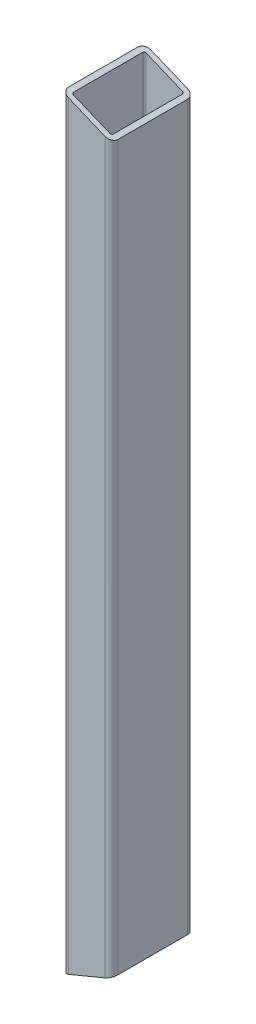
SolidWorks part; units mm, degrees
ref_plane "Plan de face" through (0, 0, 0) normal (0, 0, 1) x (1, 0, 0)
ref_plane "Plan de dessus" through (0, 0, 0) normal (0, 1, 0) x (1, 0, 0)
ref_plane "Plan de droite" through (0, 0, 0) normal (1, 0, 0) x (0, 0, -1)
ref_plane "Plan1" through (0, 0, 25) normal (0, 0, 1) x (1, 0, 0)
sketch "Esquisse1" plane through (0, 0, 25) normal (0, 0, 1) x (1, 0, 0)
  line L0 (-15, -231.35) -> (15, -218.9236)
  line L1 (15, -218.9236) -> (15, 218.9236)
  line L2 (15, 218.9236) -> (-15, 231.35)
  line L3 (-15, 231.35) -> (-15, -231.35)
extrude "Boss.-Extru.1" add sketch "Esquisse1" against normal blind 3
sketch "Esquisse2" plane through (0, 0, 22) normal (0, 0, -1) x (-1, 0, 0)
  line L0 (-15, 218.9236) -> (-12, 220.1662)
  line L1 (-12, 220.1662) -> (-12, -220.1662)
  line L2 (-12, -220.1662) -> (-15, -218.9236)
  line L3 (-15, -218.9236) -> (-15, 218.9236)
extrude "Boss.-Extru.2" add sketch "Esquisse2" along normal blind 44
sketch "Esquisse3" plane through (0, 0, 22) normal (0, 0, -1) x (-1, 0, 0)
  line L0 (15, -231.35) -> (12, -230.1074)
  line L1 (12, -230.1074) -> (12, 230.1074)
  line L2 (12, 230.1074) -> (15, 231.35)
  line L3 (15, 231.35) -> (15, -231.35)
extrude "Boss.-Extru.3" add sketch "Esquisse3" along normal blind 44
sketch "Esquisse4" plane through (0, 0, -22) normal (0, 0, -1) x (-1, 0, 0)
  line L0 (15, -231.35) -> (-15, -218.9236)
  line L1 (-15, -218.9236) -> (-15, 218.9236)
  line L2 (-15, 218.9236) -> (15, 231.35)
  line L3 (15, 231.35) -> (15, -231.35)
extrude "Boss.-Extru.4" add sketch "Esquisse4" along normal blind 3
fillet "Congé1" radius 1 4 edges at (12, 0, -22) (-12, 0, -22) (-12, 0, 22)
fillet "Congé2" radius 4 4 edges at (15, 0, 25) (-15, 0, 25) (15, 0, -25) (-15, 0, -25)
